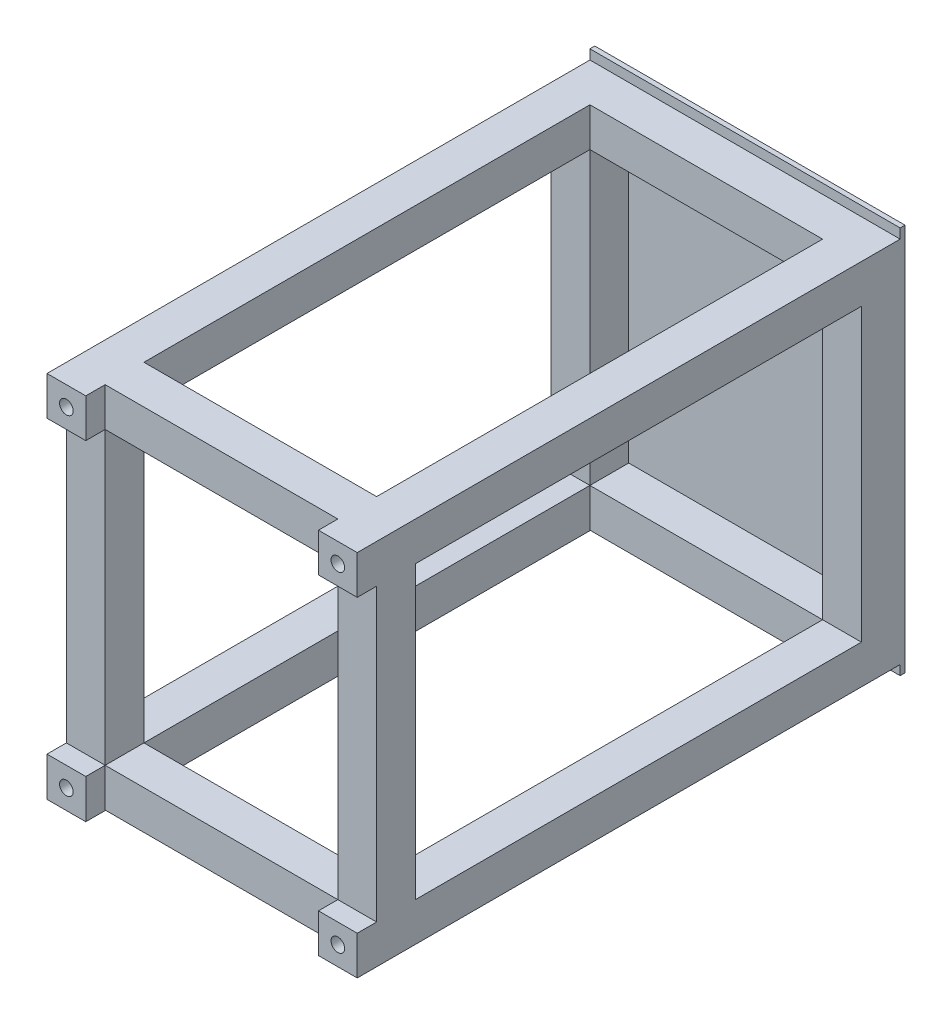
SolidWorks part; units mm, degrees
ref_plane "前视基准面" through (0, 0, 0) normal (0, 0, 1) x (1, 0, 0)
ref_plane "上视基准面" through (0, 0, 0) normal (0, 1, 0) x (1, 0, 0)
ref_plane "右视基准面" through (0, 0, 0) normal (1, 0, 0) x (0, 0, -1)
sketch "草图1" plane through (0, 0, 0) normal (0, 0, 1) x (1, 0, 0)
  line L1 (-160, 200) -> (160, 200)
  line L2 (-160, 200) -> (-160, -200)
  line L3 (-160, -200) -> (160, -200)
  line L4 (160, 200) -> (160, -200)
  line L5 (-160, 200) -> (160, -200) construction
  line L6 (-160, -200) -> (160, 200) construction
  point P0 (0, 0)
  dimension "D1" = 400
  dimension "D2" = 320
extrude "凸台-拉伸1" add sketch "草图1" along normal blind 5
sketch "草图2" plane through (0, 0, 5) normal (0, 0, 1) x (1, 0, 0)
  line L0 (160, -200) -> (160, 200) construction
  line L1 (-120, 190) -> (120, 190)
  line L2 (-120, 190) -> (-120, 150)
  line L3 (-120, 150) -> (120, 150)
  line L4 (120, 190) -> (120, 150)
  line L5 (-160, 200) -> (-160, -200) construction
  line L6 (160, 200) -> (-160, 200) construction
  line L7 (-160, 0) -> (160, 0) construction
  line L8 (120, -190) -> (120, -150)
  line L9 (-120, -150) -> (120, -150)
  line L10 (-120, -190) -> (-120, -150)
  line L11 (-120, -190) -> (120, -190)
  dimension "D1" = 40
  dimension "D2" = 40
  dimension "D3" = 40
  dimension "D4" = 10
extrude "凸台-拉伸2" add sketch "草图2" along normal blind 40
sketch "草图3" plane through (0, 0, 5) normal (0, 0, 1) x (1, 0, 0)
  line L1 (120, 190) -> (160, 190)
  line L2 (120, 190) -> (120, -190)
  line L3 (120, -190) -> (160, -190)
  line L4 (160, 190) -> (160, -190)
  line L5 (-120, 190) -> (-160, 190)
  line L6 (-120, 190) -> (-120, -190.4502)
  line L7 (-120, -190.4502) -> (-160, -190.4502)
  line L8 (-160, 190) -> (-160, -190.4502)
  dimension "D1" = 40
  dimension "D2" = 40
extrude "凸台-拉伸3" add sketch "草图3" along normal blind 40
sketch "草图4" plane through (0, 0, 45) normal (0, 0, 1) x (1, 0, 0)
  line L1 (-160, 190) -> (-120, 190)
  line L2 (-160, 190) -> (-160, 150)
  line L3 (-160, 150) -> (-120, 150)
  line L4 (-120, 190) -> (-120, 150)
  line L5 (120, 150) -> (160, 150)
  line L6 (120, 150) -> (120, 190)
  line L7 (120, 190) -> (160, 190)
  line L8 (160, 150) -> (160, 190)
  line L9 (120, -150) -> (160, -150)
  line L10 (120, -150) -> (120, -190)
  line L11 (120, -190) -> (160, -190)
  line L12 (160, -150) -> (160, -190)
  line L13 (-160, -190.4502) -> (-120, -190.4502)
  line L14 (-160, -190.4502) -> (-160, -150)
  line L15 (-160, -150) -> (-120, -150)
  line L16 (-120, -190.4502) -> (-120, -150)
extrude "凸台-拉伸4" add sketch "草图4" along normal blind 520
pattern_linear "阵列(线性)1" count 2 spacing 500 along (0, 0, 1) of "凸台-拉伸3", "凸台-拉伸2"
hole_wizard "M16 螺纹孔1" positions "草图6" profile "草图5" tap size "M16" standard "GB"
sketch "草图6" plane through (0, 0, 565) normal (0, 0, 1) x (1, 0, 0)
  point P9 (-140, 170)
  point P11 (140, 170)
  point P13 (-140, -170.2251)
  point P15 (140, -170.2251)
sketch "草图5" plane through (-140, 170, 565) normal (1, 0, 0) x (0, -1, 0)
  line L0 (0, 0) -> (0, 26.206)
  line L1 (0, 26.206) -> (7, 22)
  line L2 (7, 22) -> (7, 0)
  line L5 (7, 0) -> (0, 0)
  line L10 (0, 26.206) -> (-7, 22) construction
  line L11 (0, -6.35) -> (0, 107.95) construction
  dimension "螺纹孔钻头直径" = 14
  dimension "螺纹孔钻头深度" = 22
  dimension "导头角度" = 118
